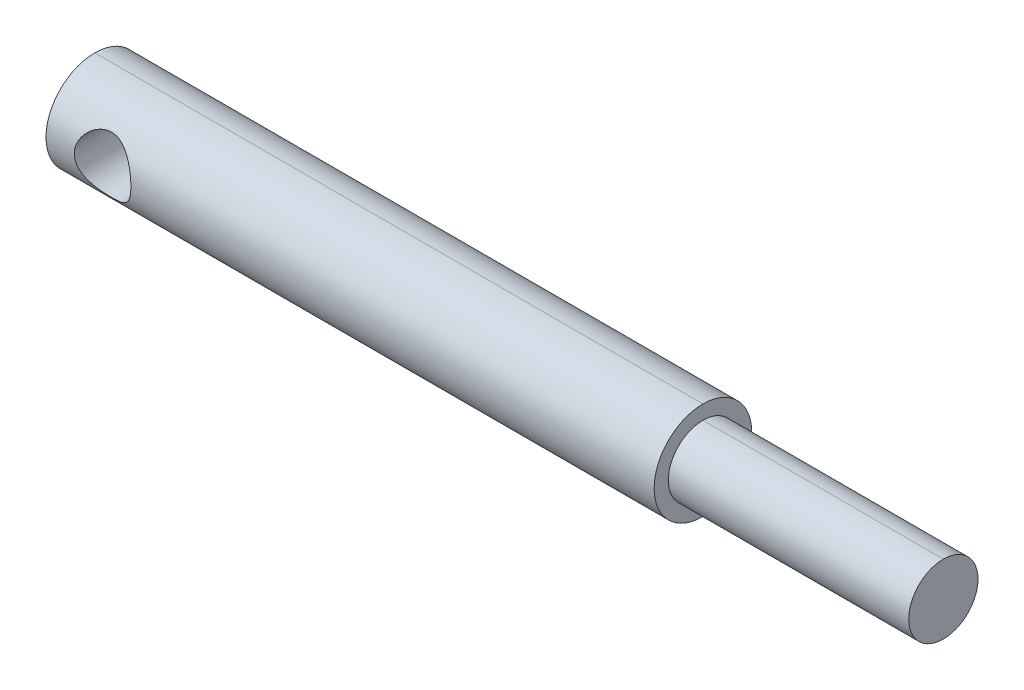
SolidWorks part; units mm, degrees
ref_plane "Front Plane" through (0, 0, 0) normal (0, 0, 1) x (1, 0, 0)
ref_plane "Top Plane" through (0, 0, 0) normal (0, 1, 0) x (1, 0, 0)
ref_plane "Right Plane" through (0, 0, 0) normal (1, 0, 0) x (0, 0, -1)
imported_body "Imported1"
sketch "Sketch1" plane through (0, 0, 0) normal (0, 0, 1) x (1, 0, 0)
  line L0 (-160, 55) -> (-126, 55) construction
  line L2 (-246, 61.9) -> (-246, 48.1) construction
  circle A0 centre (-238, 55) radius 4
  dimension "D1" = 8
  dimension "D2" = 8
extrude "Extrude1" cut sketch "Sketch1" against normal through all and the other way through all
